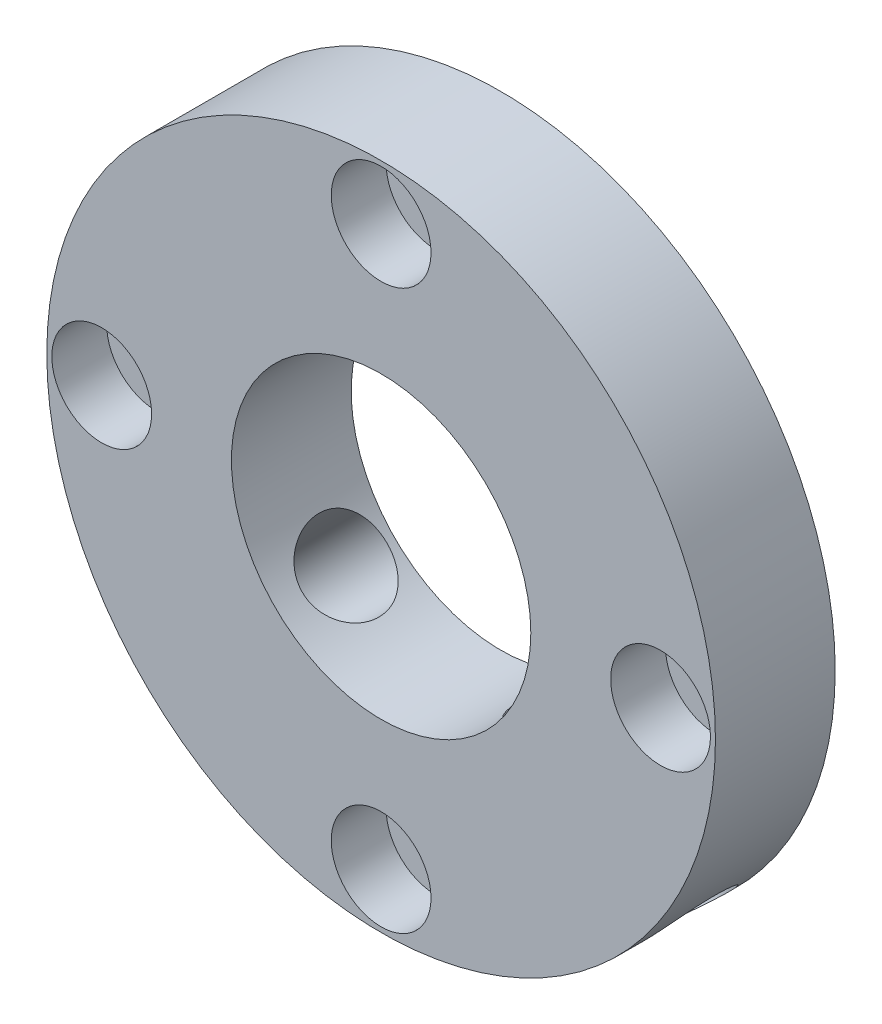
SolidWorks part; units mm, degrees
ref_plane "Front Plane" through (0, 0, 0) normal (0, 0, 1) x (1, 0, 0)
ref_plane "Top Plane" through (0, 0, 0) normal (0, 1, 0) x (1, 0, 0)
ref_plane "Right Plane" through (0, 0, 0) normal (1, 0, 0) x (0, 0, -1)
sketch "Sketch1" plane through (0, 0, 0) normal (0, 0, 1) x (1, 0, 0)
  circle A0 centre (0, 0) radius 33.5
  circle A1 centre (0, 0) radius 15
  dimension "D1" = 67
  dimension "D2" = 30
extrude "Boss-Extrude1" add sketch "Sketch1" along normal blind 12
hole_wizard "CBORE for M5 Hex Head Bolt1" positions "3DSketch1" profile "Sketch2" counterbore size "M5" standard "ANSI Metric"
sketch3d "3DSketch1"
  line L0 (0, 0, 0) -> (0, 0, 12) construction
  line L1 (0, 0, 12) -> (0, 0, 0) construction
  line L2 (0, 0, 12) -> (0, 0, 0) construction
  line L3 (0, 0, 12) -> (0, 33.5, 12) construction
  circle A1 centre (0, 0, 12) radius 33.5 construction
  point P0 (0, 28, 12)
  point P17 (0, 25.0698, 12)
  point P20 (0, 0, 45.5)
  point P21 (0, 0, 0)
  dimension "D1" = 5.5
sketch "Sketch2" plane through (0, 28, 12) normal (1, 0, 0) x (0, -1, 0)
  line L0 (0, 0) -> (0, 12)
  line L1 (0, 12) -> (2.75, 12)
  line L3 (2.75, 12) -> (2.75, 5.5)
  line L4 (2.75, 5.5) -> (5, 5.5)
  line L5 (5, 5.5) -> (5, 0)
  line L7 (5, 0) -> (0, 0)
  line L11 (0, -6.35) -> (0, 107.95) construction
  dimension "Thru Hole Dia." = 5.5
  dimension "Thru Hole Depth" = 12
  dimension "C'Bore Dia." = 10
  dimension "C'Bore Depth" = 5.5
pattern_circular "CirPattern1" count 4 over 360 about axis through (0, 0, 0) along (0, 0, 1) of "CBORE for M5 Hex Head Bolt1"
hole_wizard "Ø8.0mm Dowel Hole1" positions "3DSketch2" profile "Sketch3" hole size "Ø8.0" standard "ANSI Metric"
sketch3d "3DSketch2"
  line L3 (0, 0, 0) -> (-23.6881, -23.6881, 0) construction
  line L5 (0, 0, 0) -> (0, -38.7649, 0) construction
  line L8 (-23.6881, -23.6881, 0) -> (-23.6881, -23.6881, 5.05) construction
  circle A1 centre (0, 0, 0) radius 33.5 construction
  point P0 (-23.6881, -23.6881, 5.05)
  point P29 (0, 0, 33.5)
  point P40 (0, 0, 0)
  dimension "D1" = 5.05
  dimension "D2" = 45
sketch "Sketch3" plane through (-23.6881, -23.6881, 5.05) normal (0, 0, 1) x (0.7071, -0.7071, 0)
  line L0 (0, 0) -> (0, 18.5)
  line L1 (0, 18.5) -> (4.25, 18.5)
  line L2 (4.25, 18.5) -> (4.25, 0)
  line L5 (4.25, 0) -> (0, 0)
  line L11 (0, -6.35) -> (0, 107.95) construction
  dimension "Thru Hole Dia." = 8.5
  dimension "Thru Hole Depth" = 18.5
pattern_circular "CirPattern2" count 2 every 90 about axis through (0, 0, 12) along (0, 0, -1) of "Ø8.0mm Dowel Hole1"
